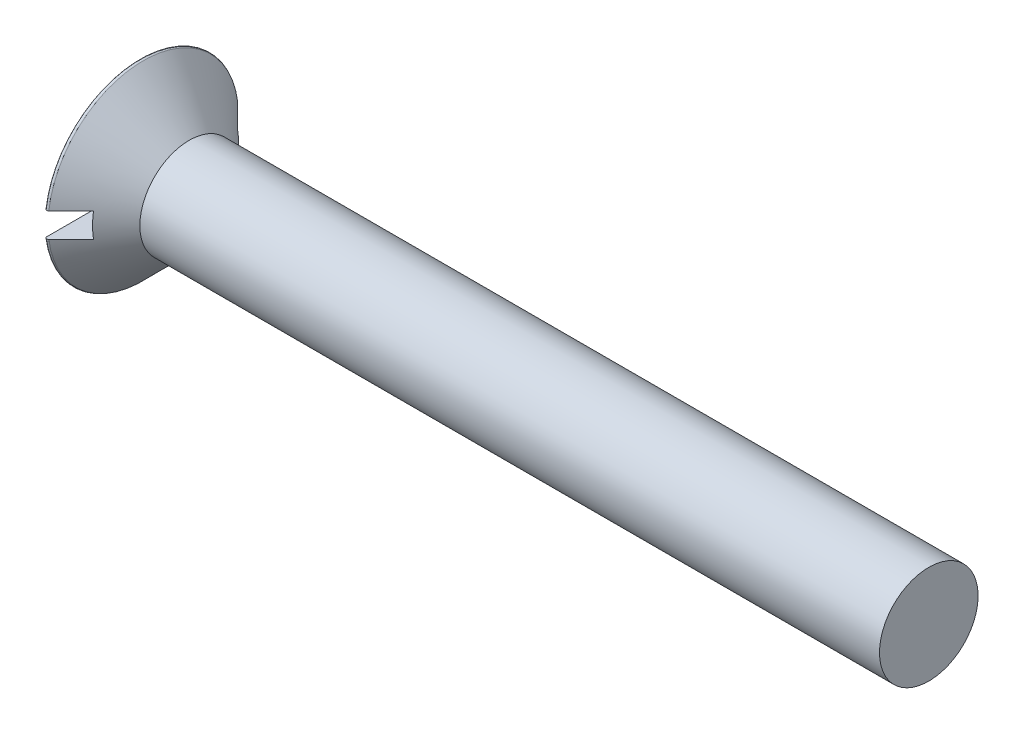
SolidWorks part; units mm, degrees
ref_plane "Front" through (0, 0, 0) normal (0, 0, 1) x (1, 0, 0)
ref_plane "Top" through (0, 0, 0) normal (0, 1, 0) x (1, 0, 0)
ref_plane "Right" through (0, 0, 0) normal (1, 0, 0) x (0, 0, -1)
other "Configuration Table"
sketch "Sketch1" plane through (0, 0, 0) normal (0, 0, 1) x (1, 0, 0)
  line L0 (0, 0) -> (0, 10)
  line L1 (0, 10) -> (5, 5)
  line L3 (80, 5) -> (80, 0)
  line L4 (80, 0) -> (0, 0)
  line L5 (-5.5696, 0) -> (0, 0) construction
  line L6 (5, 5) -> (80, 5)
revolve "Base" add sketch "Sketch1" angle 360 about L5
fillet "HeadFillet" radius 0.2 1 edges at (0, 0, 10)
sketch "Sketch2" plane through (0, 0, 0) normal (0, 0, 1) x (1, 0, 0)
  line L1 (0, 1.25) -> (2.6, 1.25)
  line L2 (0, 1.25) -> (0, -1.25)
  line L3 (0, -1.25) -> (2.6, -1.25)
  line L4 (2.6, 1.25) -> (2.6, -1.25)
extrude "Notch" cut sketch "Sketch2" against normal through all and the other way through all
sketch "Sketch3" plane through (0, 0, 0) normal (0, 0, 1) x (1, 0, 0)
  line L0 (4.4877, 0) -> (-0.464, 0) construction
  line L1 (5, 9.19) -> (41.5, 9.19)
  line L2 (5, 9.19) -> (5, 4.19)
  line L3 (5, 4.19) -> (37.7, 4.19)
  line L4 (41.5, 9.19) -> (41.5, 5)
  line L6 (41.5, 5) -> (37.7, 4.19)
  line L7 (80, -5) -> (80, 5) construction
  line L10 (0, 9.5172) -> (0, 1.25) construction
  dimension "b" = 38.5
  dimension "x" = 3.8
  dimension "D4" = 5
sketch "Sketch4" plane through (0, 0, 0) normal (0, 0, 1) x (1, 0, 0)
  line L0 (80, 4.2968) -> (80.406, 5)
  line L1 (80.406, 5) -> (80.406, 5.812)
  line L2 (80.406, 5.812) -> (79.594, 5.812)
  line L3 (79.594, 5.812) -> (79.594, 5)
  line L4 (79.594, 5) -> (80, 4.2968)
  line L5 (80, -5) -> (80, 5) construction
  line L6 (0, 0) -> (84.1591, 0) construction
revolve "Cut-Revolve10" [suppressed] cut sketch "Sketch4" angle 360 about L6
pattern_linear "LPattern10" [suppressed] count 74 spacing 0.9744 along (1, 0, 0)
equation "\"m@Sketch2\" = \"n@Sketch2\" / 2"
equation "\"D1@Sketch4\" = \"d@Sketch1\""
equation "\"D2@Sketch4\" =  ( \"d@Sketch1\" - \"D2@ThreadCosmetic1\" )  / 2"
equation "\"D3@LPattern10\" = \"D2@Sketch4\" * 1.2"
equation "\"D1@LPattern10\" = \"D1@ThreadCosmetic1\" / \"D3@LPattern10\""
